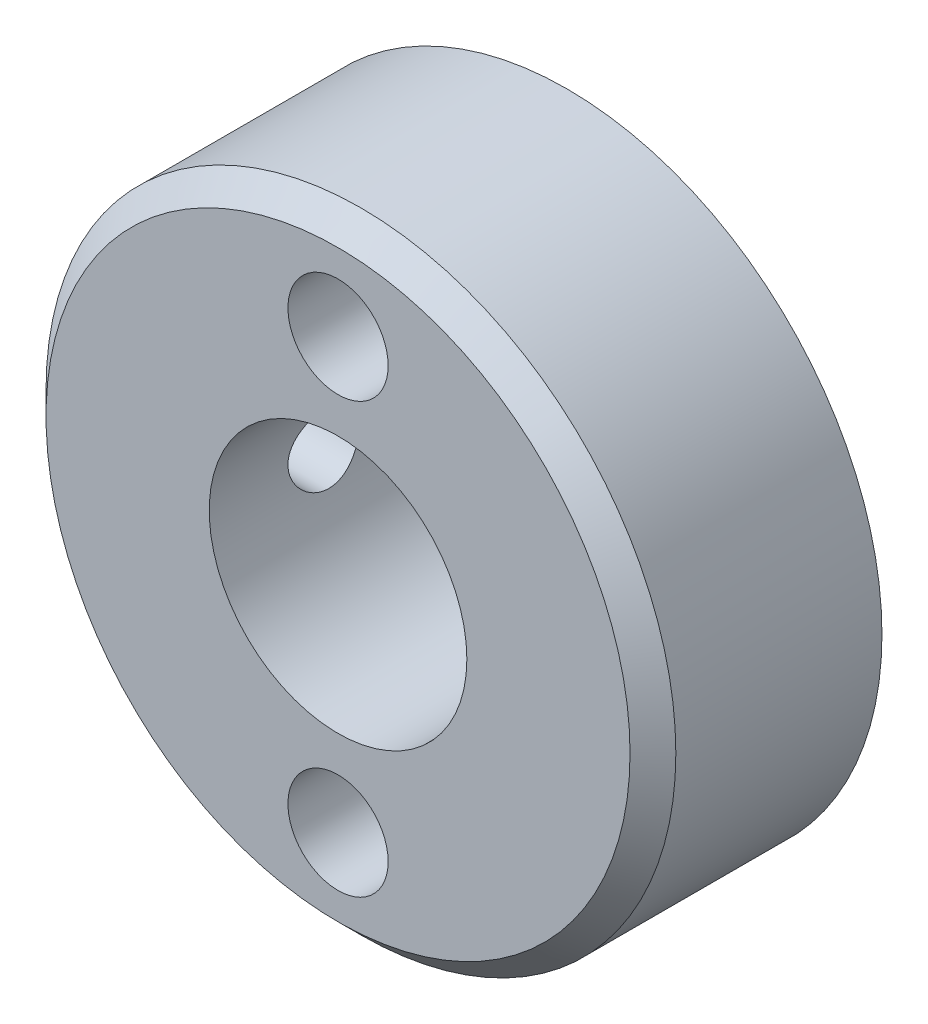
SolidWorks part; units mm, degrees
ref_plane "Front" through (0, 0, 0) normal (0, 0, 1) x (1, 0, 0)
ref_plane "Top" through (0, 0, 0) normal (0, 1, 0) x (1, 0, 0)
ref_plane "Right" through (0, 0, 0) normal (1, 0, 0) x (0, 0, -1)
other "Configuration Table"
sketch "Sketch1" plane through (0, 0, 0) normal (0, 0, 1) x (1, 0, 0)
  circle A0 centre (0, 0) radius 11
  circle A1 centre (0, 0) radius 4.5
extrude "BaseNut" add sketch "Sketch1" against normal blind 8
sketch "Sketch5" plane through (0, 0, 0) normal (1, 0, 0) x (0, 0, -1)
  line L0 (-26.3849, 0) -> (32.989, 0) construction
  line L1 (-6.0703, 7.5) -> (6.0703, 7.5) construction
  line L2 (0, 7.5) -> (0, 9.25)
  line L3 (0, 11) -> (0, -11) construction
  line L4 (0, 9.25) -> (4, 9.25)
  line L5 (4, 9.25) -> (5.0104, 7.5)
  line L6 (5.0104, 7.5) -> (0, 7.5)
  dimension "d1" = 3.5
  dimension "D2" = 60
  dimension "t" = 4
  dimension "B" = 15
revolve "Cut-Revolve1" cut sketch "Sketch5" angle 360 about L1
chamfer "Chamfer1" distance 0.8 angle 45 2 edges at (11, 0, 0) (4.5, 0, -8)
sketch "Sketch3" plane through (0, 0, 0) normal (1, 0, 0) x (0, -1, 0)
  circle A0 centre (0, 4) radius 1.25
  dimension "d2" = 2.5
  dimension "K" = 4
extrude "Cut-Extrude1" cut sketch "Sketch3" against normal through all
mirror "Mirror1" about plane through (0, 0, 0) normal (0, 1, 0) of "Cut-Revolve1"
sketch "Sketch6" plane through (0, 0, 0) normal (0, 1, 0) x (1, 0, 0)
  line L0 (0, 11.6242) -> (0, -3.0108) construction
  line L1 (4, 7.45) -> (4, 6.95)
  line L2 (4, 6.95) -> (4.5, 6.95)
  line L3 (4.5, 6.95) -> (4.933, 7.2)
  line L4 (4.933, 7.2) -> (4.5, 7.45)
  line L5 (4.5, 7.45) -> (4, 7.45)
  line L6 (4.5, 7.2) -> (-4.5, 7.2) construction
revolve "Cut-Revolve10" [suppressed] cut sketch "Sketch6" angle 360 about L0
pattern_linear "LPattern10" [suppressed] count 13 spacing 0.6 along (0, 0, -1)
equation "\"D2@Sketch6\" = \"D2@Sketch1\""
equation "\"D1@Sketch6\" = (  \"D2@ThreadCosmetic1\" - \"D2@Sketch1\" )  / 2"
equation "\"D3@LPattern10\" = \"D1@Sketch6\" * 1.2"
equation "\"D1@LPattern10\" = \"m@BaseNut\" / \"D3@LPattern10\""
